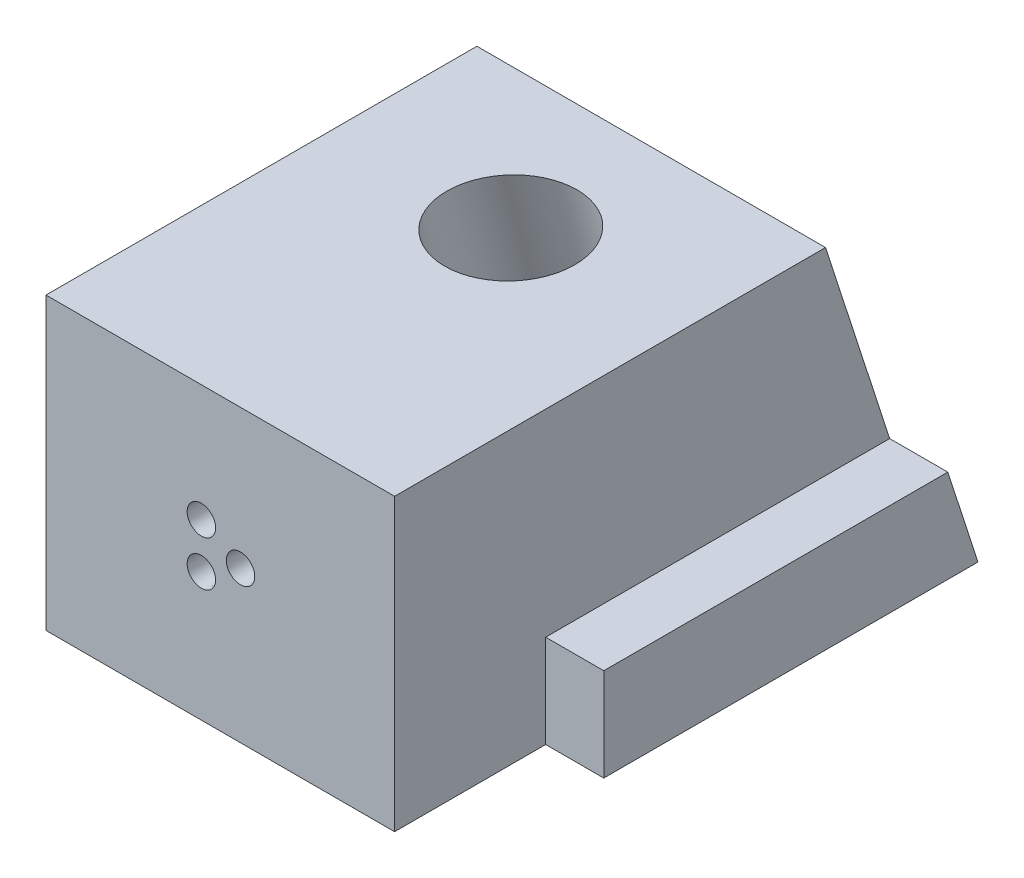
SolidWorks part; units mm, degrees
ref_plane "Face" through (0, 0, 0) normal (0, 0, 1) x (1, 0, 0)
ref_plane "Dessus" through (0, 0, 0) normal (0, 1, 0) x (1, 0, 0)
ref_plane "Droite" through (0, 0, 0) normal (1, 0, 0) x (0, 0, -1)
inserted part "BOITE<1>@MOULE temporaire"
sketch "Esquisse2" plane through (0, 22, 0) normal (0, 1, 0) x (-1, 0, 0)
  line L0 (-50, -35) -> (50, -35) construction
  line L1 (45, -35) -> (15, -35)
  line L2 (45, -35) -> (45, -22.9174)
  line L3 (45, -22.9174) -> (15, -22.9174)
  line L4 (15, -35) -> (15, -22.9174)
  dimension "D1" = 15
  dimension "D2" = 30
extrude "Enlèv. mat.-Extru.1" cut sketch "Esquisse2" against normal through all flip side to cut
sketch "Esquisse6" plane through (0, 22, 0) normal (0, 1, 0) x (-1, 0, 0)
  line L4 (45, -35) -> (45, -22.9174)
  line L5 (45, -22.9174) -> (15, -22.9174)
  line L6 (15, -22.9174) -> (15, -35)
  line L7 (15, -35) -> (45, -35)
  line L8 (45, -35) -> (45, -22.9174)
  line L9 (45, -22.9174) -> (15, -22.9174)
  line L10 (15, -22.9174) -> (15, -35)
  line L11 (15, -35) -> (45, -35)
  dimension "D1" = 0
extrude "Enlèv. mat.-Extru.2" cut sketch "Esquisse6" against normal blind 10
sketch "Esquisse3" plane through (0, 0, -35) normal (0, 0, -1) x (-1, 0, 0)
  line L4 (45, -22) -> (45, 12)
  line L5 (45, 12) -> (15, 12)
  line L6 (15, 12) -> (15, -22)
  line L7 (15, -22) -> (45, -22)
  line L8 (45, -22) -> (45, 12)
  line L9 (45, 12) -> (15, 12)
  line L10 (15, 12) -> (15, -22)
  line L11 (15, -22) -> (45, -22)
  dimension "D1" = 0
extrude "Extrusion1" add sketch "Esquisse3" along normal blind 25
sketch "Esquisse4" plane through (-15, 0, 0) normal (1, 0, 0) x (0, 0, -1)
  line L0 (60, -22) -> (60, 12)
  line L1 (60, 12) -> (71.0473, -22)
  line L2 (71.0473, -22) -> (60, -22)
  dimension "D1" = 18
extrude "Extrusion2" add sketch "Esquisse4" against normal up to surface (30 mm away)
sketch "Esquisse5" plane through (0, 0, -22.9174) normal (0, 0, 1) x (1, 0, 0)
  line L0 (-15, -22) -> (-15, 12) construction
  line L1 (-10, -5) -> (-50, -5)
  line L2 (-10, -5) -> (-10, -13)
  line L3 (-10, -13) -> (-50, -13)
  line L4 (-50, -5) -> (-50, -13)
  line L5 (-45, -22) -> (-45, 12) construction
  dimension "D1" = 5
  dimension "D2" = 5
  dimension "D3" = 8
  dimension "D4" = 5
extrude "Extrusion3" add sketch "Esquisse5" against normal up to surface (42.6062 mm away)
sketch "Esquisse7" plane through (0, 0, -22.9174) normal (0, 0, 1) x (1, 0, 0)
  line L1 (-45, -22) -> (-15, -22)
  line L2 (-45, -22) -> (-45, -13)
  line L3 (-45, -13) -> (-15, -13)
  line L4 (-15, -22) -> (-15, -13)
extrude "Enlèv. mat.-Extru.3" cut sketch "Esquisse7" against normal through all
sketch "Esquisse8" plane through (0, 0, -22.9174) normal (0, 0, 1) x (1, 0, 0)
  line L1 (-50, -13) -> (-45, -13)
  line L2 (-50, -13) -> (-50, -5)
  line L3 (-50, -5) -> (-45, -5)
  line L4 (-45, -13) -> (-45, -5)
  line L5 (-10, -13) -> (-15, -13)
  line L6 (-10, -13) -> (-10, -5)
  line L7 (-10, -5) -> (-15, -5)
  line L8 (-15, -13) -> (-15, -5)
extrude "Enlèv. mat.-Extru.4" cut sketch "Esquisse8" against normal blind 13
sketch "Esquisse9" plane through (0, 12, 0) normal (0, 1, 0) x (-1, 0, 0)
  line L0 (15, -47.9174) -> (45, -47.9174) construction
  line L1 (15, -22.9174) -> (15, -60) construction
  line L2 (45, -60) -> (45, -22.9174) construction
  line L3 (45, -22.9174) -> (15, -22.9174) construction
  dimension "D1" = 25
ref_plane "Plan1" through (0, -0.7832, -0.2099) normal (0, 0.9659, 0.2588) x (-1, 0, 0)
sketch "Esquisse10" plane through (0, -0.7832, -0.2099) normal (0, 0.9659, 0.2588) x (-1, 0, 0)
  line L0 (15, -49.3905) -> (45, -49.3905) construction
  circle A0 centre (30, -49.3905) radius 5.5
  dimension "D1" = 11
extrude "Enlèv. mat.-Extru.5" cut sketch "Esquisse10" against normal through all and the other way through all
sketch "Esquisse11" plane through (0, -13, 0) normal (0, -1, 0) x (1, 0, 0)
  line L0 (-45, -22.9174) -> (-15, -22.9174) construction
  line L1 (-45, -35.9174) -> (-45, -22.9174) construction
  circle A0 centre (-30, -32.7174) radius 2
  dimension "D1" = 4
  dimension "D2" = 9.8
  dimension "D3" = 15
extrude "Enlèv. mat.-Extru.6" cut sketch "Esquisse11" against normal blind 10 draft 60
